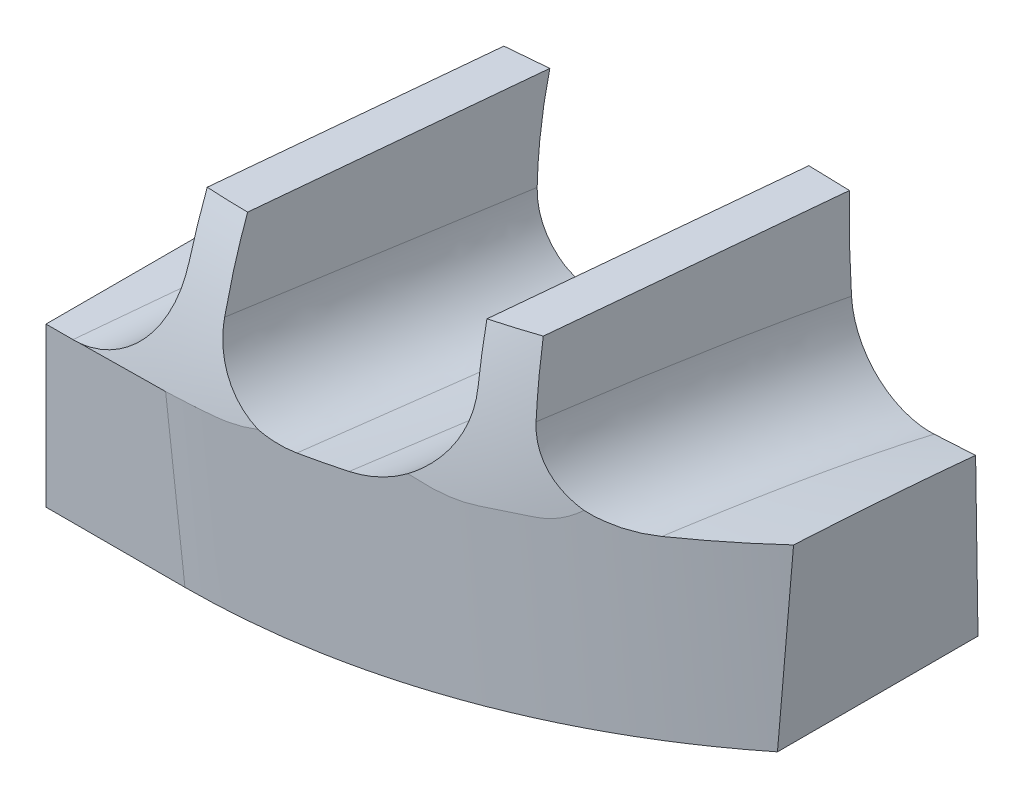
SolidWorks part; units mm, degrees
ref_plane "Ebene vorne" through (0, 0, 0) normal (0, 0, 1) x (1, 0, 0)
ref_plane "Ebene oben" through (0, 0, 0) normal (0, 1, 0) x (1, 0, 0)
ref_plane "Ebene rechts" through (0, 0, 0) normal (1, 0, 0) x (0, 0, -1)
imported_body "Radtraeger_vorne_rechts_v2~swx10-1-solid1"
other "ofset2mm" parameters "D1"=2
other "ofset2mm~" parameters "D1"=2
fillet "Verrundung1" radius 10 1 edges at (91.7193, 18.9856, -30.4843)
fillet "Verrundung2" radius 10 1 edges
fillet "Verrundung3" radius 10 1 edges
other "ofset max.1,96!" parameters "D1"=1.96
other "Fläche verschieben10" parameters "D1"=1.99
